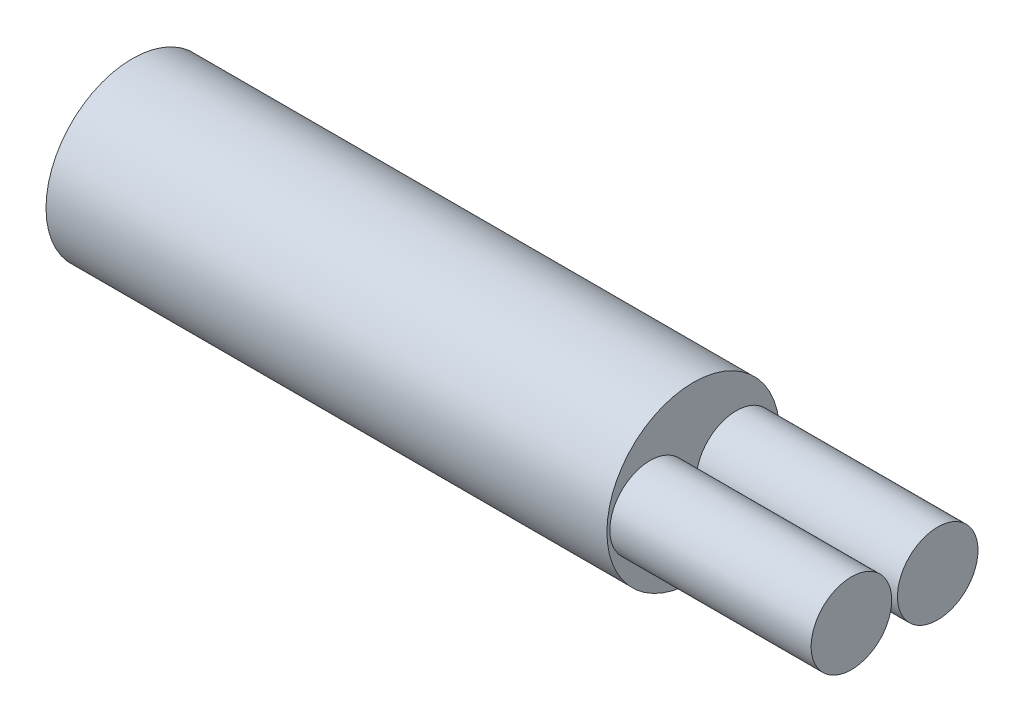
SolidWorks part; units mm, degrees
ref_plane "Ebene vorne" through (0, 0, 0) normal (0, 0, 1) x (1, 0, 0)
ref_plane "Ebene oben" through (0, 0, 0) normal (0, 1, 0) x (1, 0, 0)
ref_plane "Ebene rechts" through (0, 0, 0) normal (1, 0, 0) x (0, 0, -1)
sketch "Skizze1" plane through (0, 0, 0) normal (1, 0, 0) x (0, 0, -1)
  circle A0 centre (0, 0) radius 3
  dimension "D1" = 6
extrude "Aufsatz-Linear austragen1" add sketch "Skizze1" against normal blind 19.5
sketch "Skizze2" plane through (0, 0, 0) normal (1, 0, 0) x (0, 0, -1)
  circle A1 centre (-1.5, 0) radius 1.4
  circle A2 centre (1.5, 0) radius 1.4
  dimension "D1" = 2.8
  dimension "D2" = 1.5
  dimension "D3" = 1.5
extrude "Aufsatz-Linear austragen4" add sketch "Skizze2" along normal blind 7
